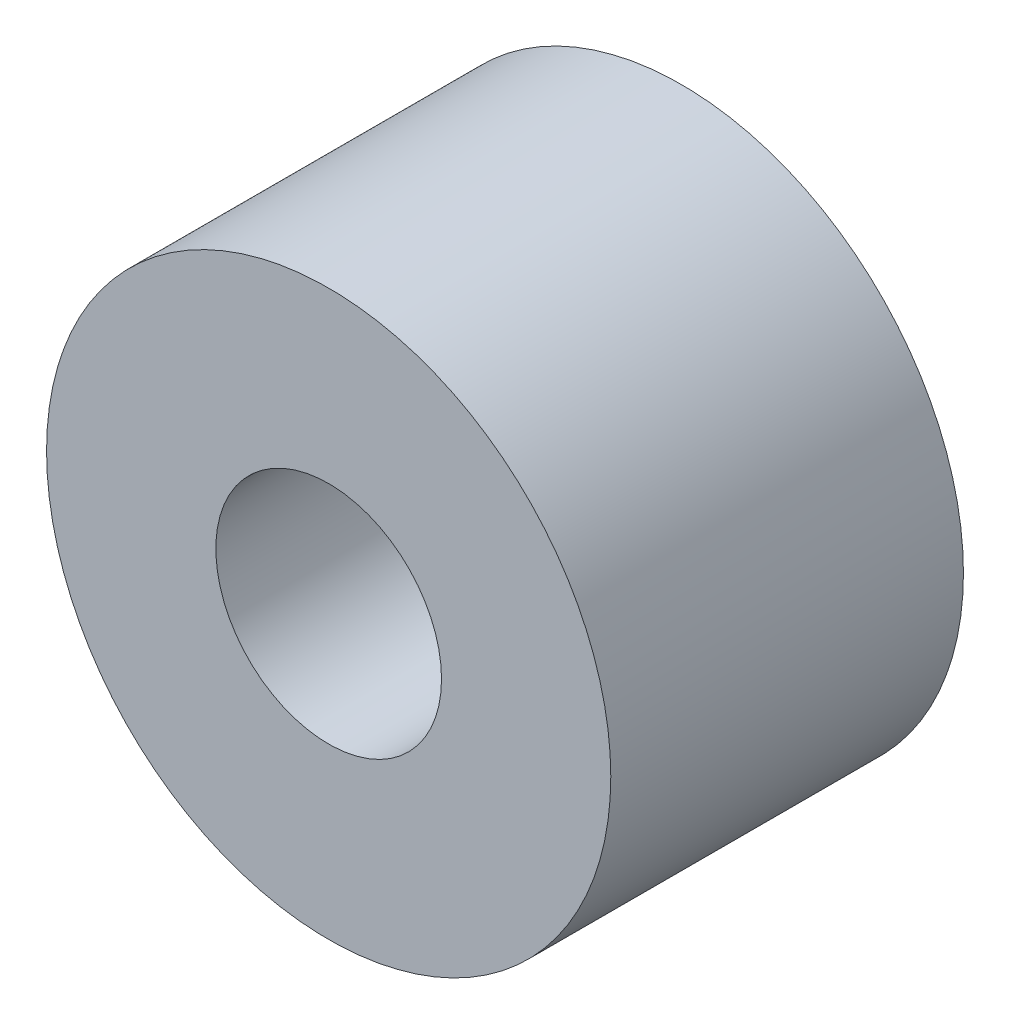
SolidWorks part; units mm, degrees
ref_plane "Alzado" through (0, 0, 0) normal (0, 0, 1) x (1, 0, 0)
ref_plane "Planta" through (0, 0, 0) normal (0, 1, 0) x (1, 0, 0)
ref_plane "Vista lateral" through (0, 0, 0) normal (1, 0, 0) x (0, 0, -1)
sketch "Croquis1" plane through (0, 0, 0) normal (0, 0, 1) x (1, 0, 0)
  circle A0 centre (0, 0) radius 4
extrude "Saliente-Extruir1" add sketch "Croquis1" against normal blind 5 contours A0
sketch "Croquis2" plane through (0, 0, 0) normal (0, 0, 1) x (1, 0, 0)
  circle A0 centre (0, 0) radius 1.6
extrude "Cortar-Extruir1" cut sketch "Croquis2" against normal blind 5 contours A0
